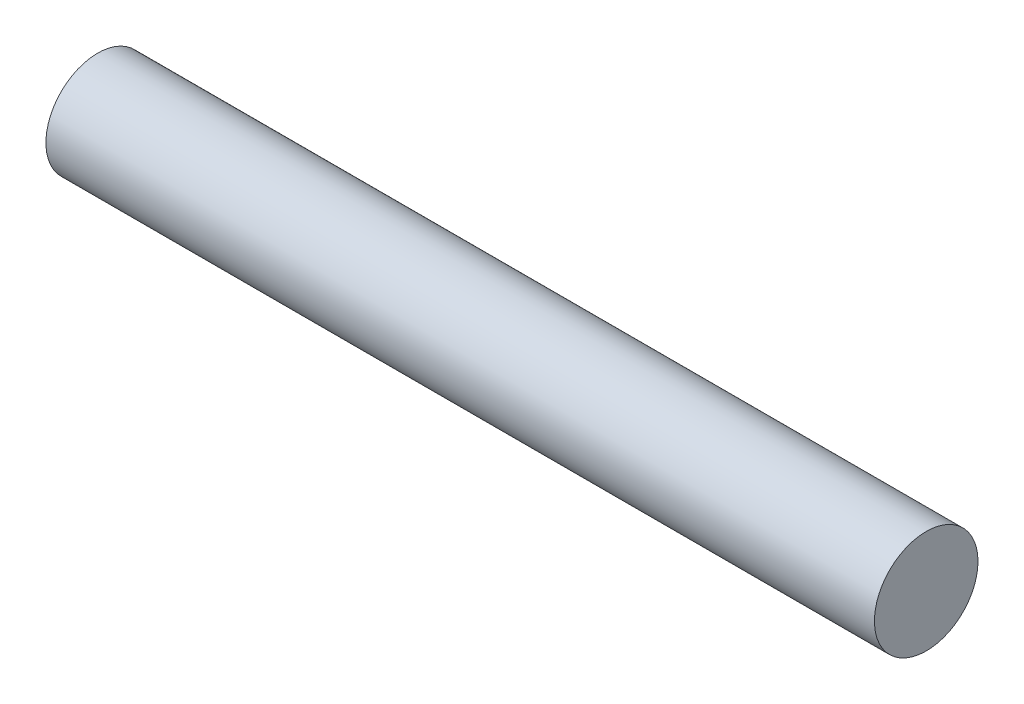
SolidWorks part; units mm, degrees
ref_plane "Front Plane" through (0, 0, 0) normal (0, 0, 1) x (1, 0, 0)
ref_plane "Top Plane" through (0, 0, 0) normal (0, 1, 0) x (1, 0, 0)
ref_plane "Right Plane" through (0, 0, 0) normal (1, 0, 0) x (0, 0, -1)
sketch "Sketch1" plane through (0, 0, 0) normal (1, 0, 0) x (0, 0, -1)
  circle A0 centre (0, 0) radius 3.175
  dimension "D1" = 6.35
extrude "Extrude1" add sketch "Sketch1" along normal blind 50.8
